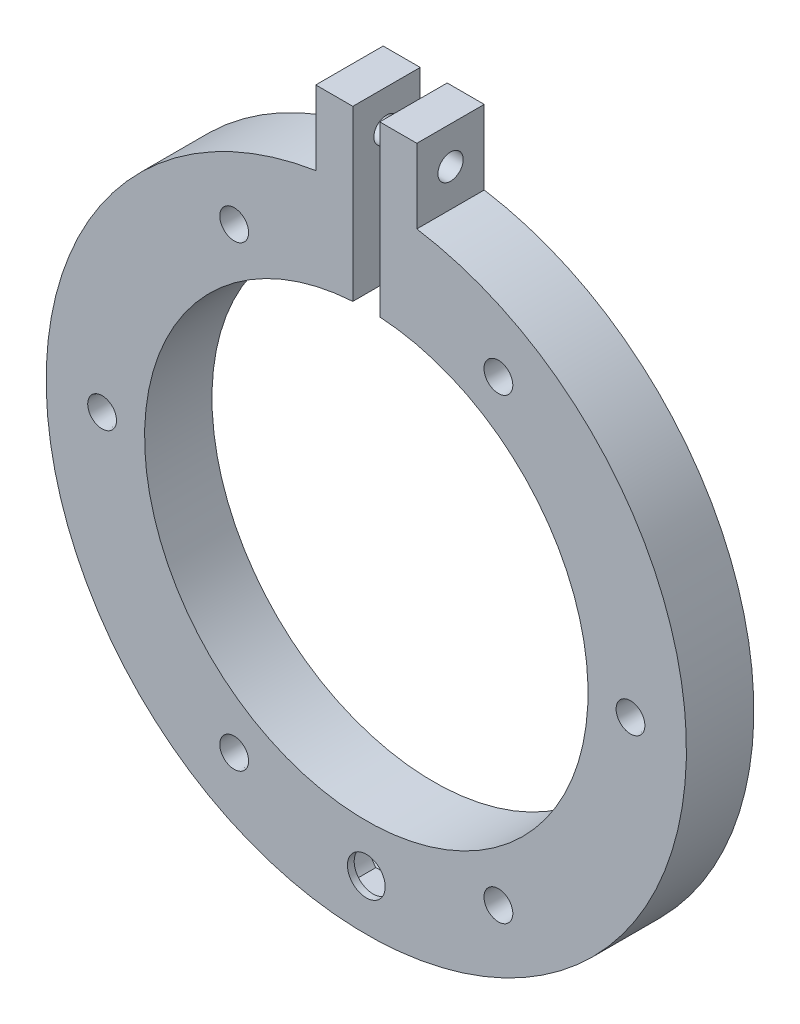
SolidWorks part; units mm, degrees
ref_plane "Front Plane" through (0, 0, 0) normal (0, 0, 1) x (1, 0, 0)
ref_plane "Top Plane" through (0, 0, 0) normal (0, 1, 0) x (1, 0, 0)
ref_plane "Right Plane" through (0, 0, 0) normal (1, 0, 0) x (0, 0, -1)
sketch "Sketch1" plane through (0, 0, 0) normal (0, 0, 1) x (1, 0, 0)
  circle A0 centre (0, 0) radius 41.783
  circle A1 centre (0, 0) radius 60.325
  dimension "D1" = 83.566
  dimension "D2" = 120.65
extrude "Boss-Extrude1" add sketch "Sketch1" along normal blind 12.7
sketch "Sketch2" plane through (0, 0, 0) normal (0, 0, -1) x (-1, 0, 0)
  line L0 (0, 37.568) -> (0, 62.133) construction
  line L1 (2.54, 37.568) -> (2.54, 62.133)
  line L2 (-2.54, 37.568) -> (-2.54, 62.133)
  line L3 (-2.54, 62.133) -> (2.54, 62.133)
  line L4 (-2.54, 37.568) -> (2.54, 37.568)
  line L5 (-2.54, 0) -> (-2.54, 83.3673) construction
  line L6 (0, 0) -> (0, 83.3673) construction
  line L7 (2.54, 0) -> (2.54, 83.3673) construction
  dimension "D1" = 2.54
  dimension "D2" = 2.54
extrude "Cut-Extrude1" cut sketch "Sketch2" against normal through all
sketch "Sketch3" plane through (0, 0, 0) normal (0, 0, -1) x (-1, 0, 0)
  line L0 (2.54, 73.544) -> (9.525, 73.544)
  line L1 (2.54, 53.1975) -> (2.54, 73.544)
  line L2 (-2.54, 53.1975) -> (-2.54, 73.544)
  line L3 (9.525, 53.1975) -> (9.525, 73.544)
  line L4 (-9.525, 53.1975) -> (-9.525, 73.544)
  line L5 (-9.525, 73.544) -> (-2.54, 73.544)
  line L6 (-9.525, 53.1975) -> (-2.54, 53.1975)
  line L12 (2.54, 53.1975) -> (9.525, 53.1975)
extrude "Boss-Extrude2" add sketch "Sketch3" against normal blind 12.7
sketch "Sketch4" plane through (9.525, 0, 0) normal (1, 0, 0) x (0, 0, -1)
  circle A0 centre (-6.35, 66.5561) radius 2.3812
  dimension "D1" = 4.7625
extrude "Cut-Extrude2" cut sketch "Sketch4" against normal through all
sketch "Sketch5" plane through (0, 0, 0) normal (0, 0, -1) x (-1, 0, 0)
  circle A0 centre (0, 0) radius 57.15
  circle A1 centre (0, 0) radius 44.45
  dimension "D1" = 114.3
  dimension "D2" = 88.9
extrude "Cut-Extrude3" cut sketch "Sketch5" against normal blind 6.35
sketch "Sketch6" plane through (0, 0, 6.35) normal (0, 0, -1) x (-1, 0, 0)
  line L0 (0, 0) -> (-40.7194, 70.528) construction
  line L1 (0, 0) -> (0, 49.5698) construction
  circle A0 centre (-24.892, 43.1142) radius 2.3813
  circle A1 centre (24.892, 43.1142) radius 2.3813
  circle A2 centre (49.784, 0) radius 2.3813
  circle A3 centre (24.892, -43.1142) radius 2.3813
  circle A4 centre (-24.892, -43.1142) radius 2.3813
  circle A5 centre (-49.784, 0) radius 2.3813
  point P19 (0, 0)
  dimension "D2" = 4.7625
  dimension "D1" = 30
  dimension "D3" = 49.784
  dimension "D4" = 6
extrude "Cut-Extrude4" cut sketch "Sketch6" against normal blind 6.35 draft 3
ref_plane "Plane1" through (0, -60.325, 0) normal (0, 1, 0) x (1, 0, 0)
sketch "Sketch8" plane through (0, -60.325, 0) normal (0, 1, 0) x (1, 0, 0)
  circle A0 centre (0, -3.5494) radius 2.54
extrude "Cut-Extrude6" cut sketch "Sketch8" along normal blind 10.1617
sketch "Sketch9" plane through (0, 0, 6.35) normal (0, 0, -1) x (-1, 0, 0)
  line L0 (0, -44.45) -> (0, -44.704) construction
  line L1 (-6.096, -50.8) -> (6.096, -50.8) construction
  line L2 (-4.5437, -54.864) -> (4.5437, -54.864)
  line L3 (-4.5437, -46.736) -> (4.5437, -46.736)
  line L4 (-8.3741, -46.736) -> (10.0957, -46.736) construction
  line L5 (0, -46.736) -> (0, -54.864) construction
  line L6 (-8.3741, -50.8) -> (10.0957, -50.8) construction
  line L7 (-8.3741, -54.864) -> (10.0957, -54.864) construction
  line L8 (0, -56.896) -> (0, -57.15) construction
  arc A0 (-4.5437, -46.736) -> (-4.5437, -54.864) centre (0, -50.8) ccw
  arc A1 (-2.54, 44.3774) -> (2.54, 44.3774) centre (0, 0) ccw construction
  arc A2 (-2.54, 57.0935) -> (2.54, 57.0935) centre (0, 0) ccw construction
  arc A3 (4.5437, -54.864) -> (4.5437, -46.736) centre (0, -50.8) ccw
  dimension "D1" = 12.192
  dimension "D2" = 4.064
  dimension "D3" = 4.064
extrude "Cut-Extrude7" cut sketch "Sketch9" against normal blind 5.08
sketch "Sketch10" plane through (0, 0, 11.43) normal (0, 0, -1) x (-1, 0, 0)
  circle A0 centre (0, -50.8) radius 3.556
  dimension "D1" = 7.112
extrude "Cut-Extrude8" cut sketch "Sketch10" against normal through all
